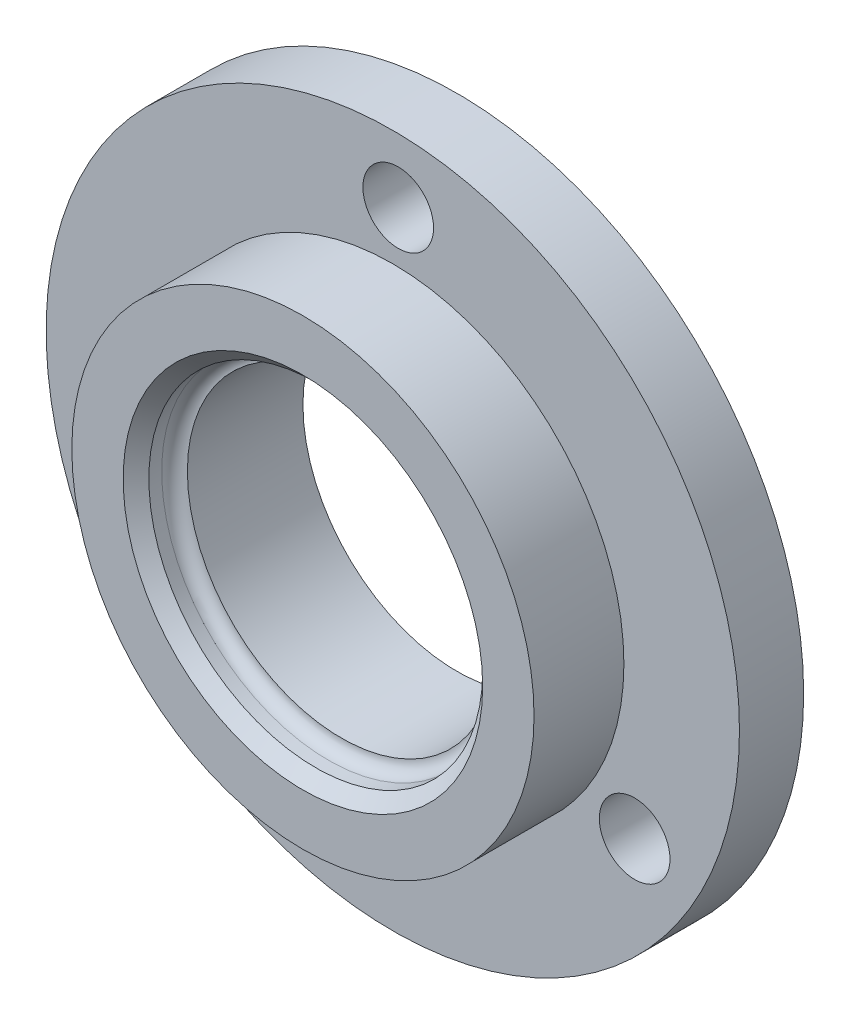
SolidWorks part; units mm, degrees
ref_plane "Plan de face" through (0, 0, 0) normal (0, 0, 1) x (1, 0, 0)
ref_plane "Plan de dessus" through (0, 0, 0) normal (0, 1, 0) x (1, 0, 0)
ref_plane "Plan de droite" through (0, 0, 0) normal (1, 0, 0) x (0, 0, -1)
sketch "Esquisse1" plane through (0, 0, 0) normal (0, 0, 1) x (1, 0, 0)
  circle A0 centre (0, 0) radius 27
  dimension "D1" = 54
extrude "Extrusion1" add sketch "Esquisse1" along normal blind 5
sketch "Esquisse2" plane through (0, 0, 5) normal (0, 0, 1) x (1, 0, 0)
  circle A0 centre (0, 0) radius 18
  dimension "D1" = 36
extrude "Extrusion2" add sketch "Esquisse2" along normal blind 7
sketch "Esquisse3" plane through (0, 0, 12) normal (0, 0, 1) x (1, 0, 0)
  circle A0 centre (0, 0) radius 13
  dimension "D1" = 26
extrude "Enlèv. mat.-Extru.2" cut sketch "Esquisse3" against normal blind 3
fillet "Congé1" radius 1 1 edges at (13, 0, 9)
hole_wizard "Dégagement M51" positions "Esquisse3D1" profile "Esquisse4" hole size "M5" standard "ISO"
sketch3d "Esquisse3D1"
  line L0 (0, 0, 0) -> (0.5848, 30.4108, 0) construction
  point P0 (0.423, 21.9959, 0)
  dimension "D1" = 22
sketch "Esquisse4" plane through (0.423, 21.9959, 0) normal (1, 0, 0) x (0, 1, 0)
  line L0 (0, 0) -> (0, 12)
  line L1 (0, 12) -> (2.75, 12)
  line L2 (2.75, 12) -> (2.75, 0)
  line L5 (2.75, 0) -> (0, 0)
  line L11 (0, -6.35) -> (0, 107.95) construction
  dimension "Diamètre du perçage jusqu'au prochain" = 5.5
  dimension "Profondeur du perçage jusqu'au prochain" = 12
pattern_circular "Répétition circulaire1" count 3 every 120 about axis through (0, 0, 0) along (0, 0, 1) of "Dégagement M51"
sketch "Esquisse5" plane through (0, 0, 0) normal (0, 0, -1) x (-1, 0, 0)
  circle A0 centre (0, 0) radius 12
  dimension "D1" = 24
extrude "Enlèv. mat.-Extru.3" cut sketch "Esquisse5" against normal through all
chamfer "Chanfrein1" distance 1 angle 45 1 edges at (13, 0, 12)
